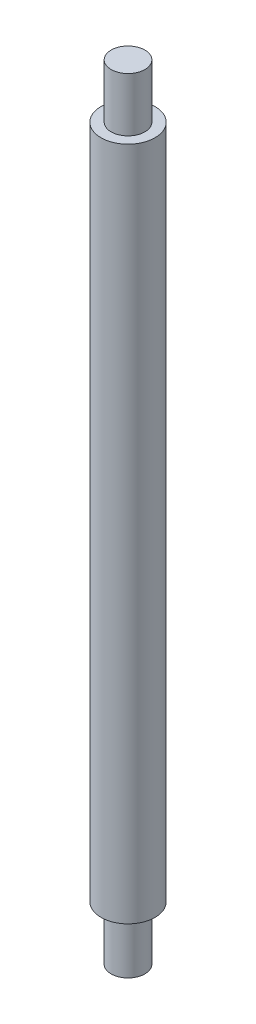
SolidWorks part; units mm, degrees
ref_plane "Front Plane" through (0, 0, 0) normal (0, 0, 1) x (1, 0, 0)
ref_plane "Top Plane" through (0, 0, 0) normal (0, 1, 0) x (1, 0, 0)
ref_plane "Right Plane" through (0, 0, 0) normal (1, 0, 0) x (0, 0, -1)
sketch "Sketch1" plane through (0, 0, 0) normal (0, 0, 1) x (1, 0, 0)
  line L0 (0, -58) -> (0, 58)
  line L1 (4, 50) -> (4, -50)
  line L2 (-1000, 0) -> (49000, 0) construction
  line L3 (0, 58) -> (2.5, 58)
  line L4 (2.5, 58) -> (2.5, 50)
  line L5 (2.5, 50) -> (4, 50)
  line L6 (4, -50) -> (2.5, -50)
  line L7 (2.5, -50) -> (2.5, -58)
  line L8 (2.5, -58) -> (0, -58)
  point P6 (0, 0)
  point P11 (4, 0)
  dimension "D1" = 116
  dimension "D2" = 100
  dimension "D3" = 4
  dimension "D4" = 2.5
revolve "Revolve1" add sketch "Sketch1" angle 360 about L0
